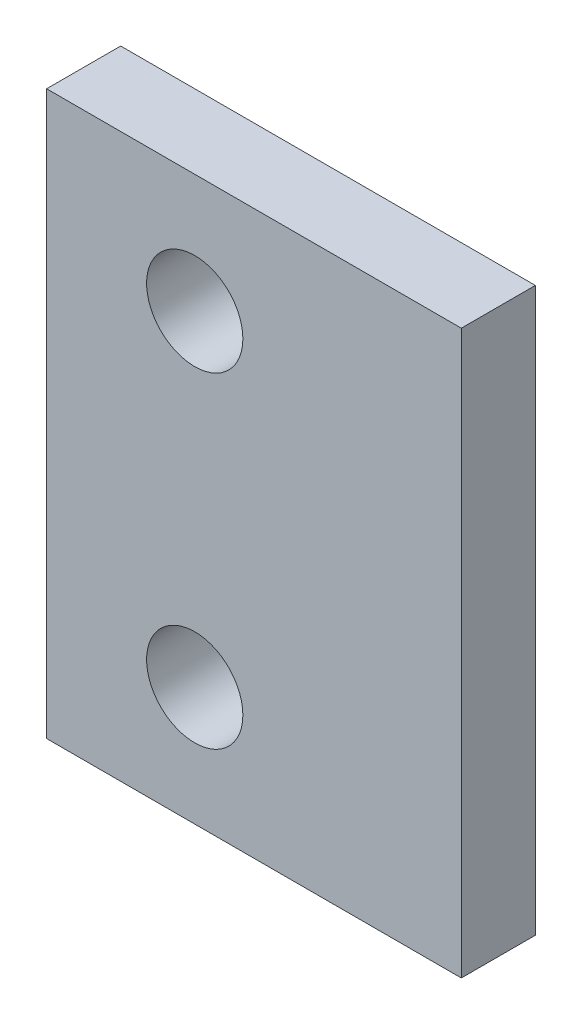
SolidWorks part; units mm, degrees
ref_plane "前视基准面" through (0, 0, 0) normal (0, 0, 1) x (1, 0, 0)
ref_plane "上视基准面" through (0, 0, 0) normal (0, 1, 0) x (1, 0, 0)
ref_plane "右视基准面" through (0, 0, 0) normal (1, 0, 0) x (0, 0, -1)
sketch "草图1" plane through (0, 0, 0) normal (0, 0, 1) x (1, 0, 0)
  line L0 (0, 0) -> (28, 0)
  line L1 (0, -38) -> (28, -38)
  line L2 (0, -38) -> (0, 0)
  line L3 (28, -38) -> (28, 0)
  circle A0 centre (10, -8) radius 3.25
  circle A1 centre (10, -30) radius 3.25
extrude "凸台-拉伸1" add sketch "草图1" along normal blind 5
